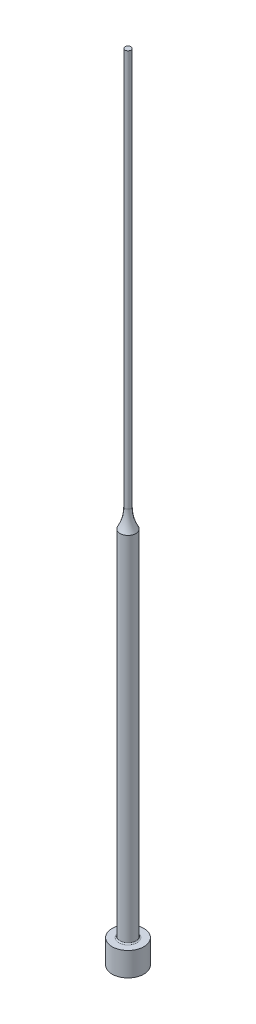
SolidWorks part; units mm, degrees
ref_plane "Front Plane" through (0, 0, 0) normal (0, 0, 1) x (1, 0, 0)
ref_plane "Top Plane" through (0, 0, 0) normal (0, 1, 0) x (1, 0, 0)
ref_plane "Right Plane" through (0, 0, 0) normal (1, 0, 0) x (0, 0, -1)
sketch "Sketch1" plane through (0, 0, 0) normal (0, 0, 1) x (1, 0, 0)
  line L0 (0, 0) -> (4, 0)
  line L1 (55, 0) -> (-55, 0) construction
  line L2 (4, 0) -> (4, 6)
  line L3 (4, 6) -> (2.3, 6)
  line L4 (2, 6.3) -> (2, 95.1588)
  line L6 (0.75, 100) -> (0.75, 200)
  line L7 (0.75, 200) -> (0, 200)
  line L8 (0, 200) -> (0, 0)
  arc A0 (0.75, 100) -> (2, 95.1588) centre (10.75, 100) ccw
  arc A1 (2.3, 6) -> (2, 6.3) centre (2.3, 6.3) cw
  dimension "D7" = 100
  dimension "D8" = 0.3
  dimension "D5" = 10
  dimension "D1" = 0.75
  dimension "D2" = 2
  dimension "D3" = 4
  dimension "D4" = 6
  dimension "D6" = 200
revolve "Revolve1" add sketch "Sketch1" angle 360 about L8
